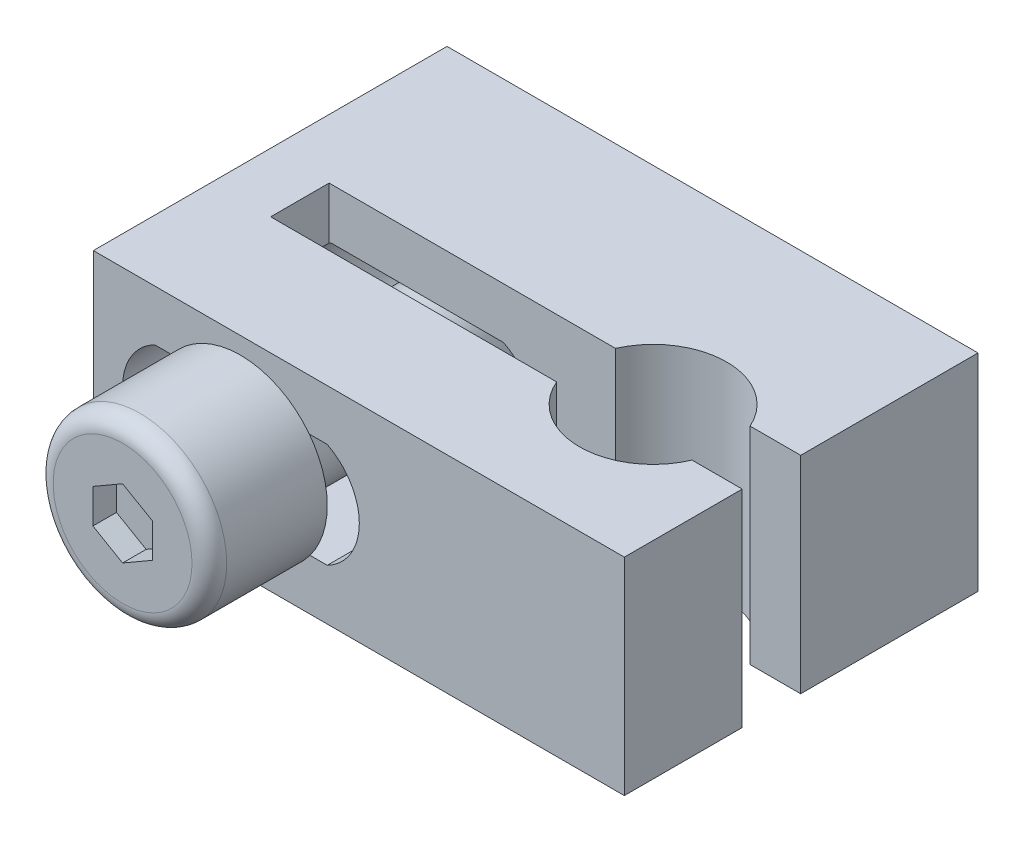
SolidWorks part; units mm, degrees
ref_plane "Front Plane" through (0, 0, 0) normal (0, 0, 1) x (1, 0, 0)
ref_plane "Top Plane" through (0, 0, 0) normal (0, 1, 0) x (1, 0, 0)
ref_plane "Right Plane" through (0, 0, 0) normal (1, 0, 0) x (0, 0, -1)
ref_plane "Plane1" through (0, 0, -4.7625) normal (0, 0, 1) x (1, 0, 0)
ref_plane "Plane2" through (0, -2.7813, 0) normal (0, 1, 0) x (-1, 0, 0)
ref_plane "Plane3" through (-7.1501, 0, 0) normal (1, 0, 0) x (0, 0, -1)
sketch "Sketch1" plane through (0, 0, -4.7625) normal (0, 0, 1) x (1, 0, 0)
  line L0 (-7.1501, -2.7813) -> (7.1501, -2.7813)
  line L1 (7.1501, -2.7813) -> (7.1501, 2.7813)
  line L2 (7.1501, 2.7813) -> (-7.1501, 2.7813)
  line L3 (-7.1501, 2.7813) -> (-7.1501, -2.7813)
extrude "Extrude1" add sketch "Sketch1" along normal blind 9.525
sketch "Sketch2" plane through (0, 0, -4.7625) normal (0, 0, 1) x (1, 0, 0)
  line L0 (-5.4991, -1.4097) -> (-0.8509, -1.4097)
  line L1 (-0.8509, 1.4097) -> (-5.4991, 1.4097)
  arc A0 (-5.4991, 1.4097) -> (-5.4991, -1.4097) centre (-4.7803, 0) ccw
  arc A1 (-0.8509, -1.4097) -> (-0.8509, 1.4097) centre (-1.5697, 0) ccw
extrude "Cut-Extrude1" cut sketch "Sketch2" along normal blind 9.525
sketch "Sketch3" plane through (0, -2.7813, 0) normal (0, 1, 0) x (-1, 0, 0)
  line L0 (5.5499, 0.0127) -> (5.5499, 1.5875)
  line L1 (5.5499, 1.5875) -> (-2.1516, 1.5875)
  line L2 (-5.7986, 1.5875) -> (-7.1501, 1.5875)
  line L3 (-7.1501, 1.5875) -> (-7.1501, 0.0127)
  line L4 (-7.1501, 0.0127) -> (-5.7876, 0.0127)
  line L5 (-2.1626, 0.0127) -> (5.5499, 0.0127)
  arc A0 (-2.1516, 1.5875) -> (-5.7986, 1.5875) centre (-3.9751, 0.8128) ccw
  arc A1 (-5.7876, 0.0127) -> (-2.1626, 0.0127) centre (-3.9751, 0.8128) ccw
extrude "Cut-Extrude2" cut sketch "Sketch3" along normal blind 5.5626
ref_plane "Plane4" through (0, 0.4699, 0) normal (0, 1, 0) x (-1, 0, 0)
ref_plane "Plane5" through (0, 0, 7.3025) normal (0, 0, 1) x (1, 0, 0)
ref_plane "Plane6" through (0, -0.0127, 0) normal (0, 1, 0) x (-1, 0, 0)
sketch "Sketch4" plane through (0, -0.0127, 0) normal (0, 1, 0) x (-1, 0, 0)
  line L0 (3.1877, 7.9375) -> (5.0571, 7.9375)
  line L1 (5.5245, 7.4701) -> (5.5245, 4.7625)
  line L2 (5.5245, 4.7625) -> (4.5303, 4.7625)
  line L3 (4.5303, 4.7625) -> (4.5303, -4.7625)
  line L4 (4.5303, -4.7625) -> (3.1877, -4.7625)
  line L5 (3.1877, -4.7625) -> (3.1877, 7.9375)
  line L6 (3.1877, -4.7625) -> (3.1877, 7.9375) construction
  arc A0 (5.0571, 7.9375) -> (5.5245, 7.4701) centre (5.0571, 7.4701) cw
revolve "Revolve1" add sketch "Sketch4" angle 360 about L6
ref_plane "Plane7" through (0, 0, 7.3025) normal (0, 0, 1) x (1, 0, 0)
sketch "Sketch5" plane through (0, 0, 7.3025) normal (0, 0, 1) x (1, 0, 0)
  line L0 (-3.9878, 0.4492) -> (-3.9878, -0.4746)
  line L1 (-3.9878, -0.4746) -> (-3.1877, -0.9366)
  line L2 (-3.1877, -0.9366) -> (-2.3876, -0.4746)
  line L3 (-2.3876, -0.4746) -> (-2.3876, 0.4492)
  line L4 (-2.3876, 0.4492) -> (-3.1877, 0.9112)
  line L5 (-3.1877, 0.9112) -> (-3.9878, 0.4492)
extrude "Cut-Extrude3" cut sketch "Sketch5" along normal blind 1.5875
ref_plane "Plane8" through (0, 9.7028, 0) normal (0, 1, 0) x (-1, 0, 0)
ref_plane "Plane9" through (0, -9.7028, 0) normal (0, 1, 0) x (-1, 0, 0)
